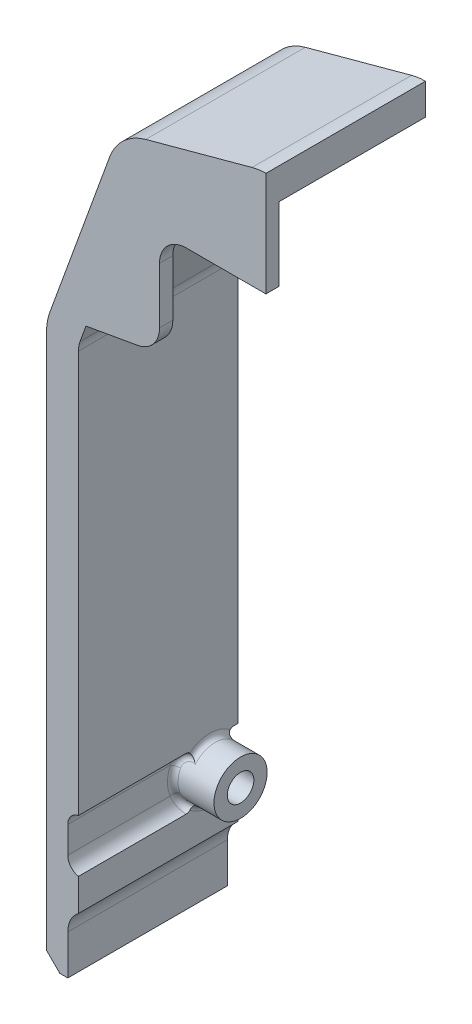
SolidWorks part; units mm, degrees
ref_plane "Face" through (0, 0, 0) normal (0, 0, 1) x (1, 0, 0)
ref_plane "Dessus" through (0, 0, 0) normal (0, 1, 0) x (1, 0, 0)
ref_plane "Droite" through (0, 0, 0) normal (1, 0, 0) x (0, 0, -1)
sketch "Esquisse1" plane through (0, 0, 0) normal (0, 0, 1) x (1, 0, 0)
  line L0 (-74.5, 0) -> (-82.5, 0)
  line L1 (-82.5, 0) -> (-82.5, 206.4735)
  line L2 (-81.2939, 213.3139) -> (-58.7478, 275.2586)
  line L3 (-45.1984, 287.7183) -> (0, 300)
  line L4 (0, 300) -> (0, 287.5649)
  line L5 (0, 287.5649) -> (-41.0513, 276.4101)
  line L6 (-47.8261, 270.1802) -> (-69.8969, 209.541)
  line L7 (-70.5, 206.1208) -> (-70.5, 54.899)
  line L8 (-74.5, 0) -> (-74.5, 15)
  line L9 (-74.5, 50) -> (-74.5, 40)
  line L10 (-70.5, 35.101) -> (-70.5, 23)
  arc A0 (-74.5, 15) -> (-70.5, 23) centre (-64.5, 15) cw
  arc A1 (-74.5, 40) -> (-70.5, 35.101) centre (-69.5, 40) ccw
  arc A2 (-74.5, 50) -> (-70.5, 54.899) centre (-69.5, 50) cw
  arc A3 (-41.0513, 276.4101) -> (-47.8261, 270.1802) centre (-38.4291, 266.76) ccw
  arc A4 (-69.8969, 209.541) -> (-70.5, 206.1208) centre (-60.5, 206.1208) ccw
  arc A5 (-82.5, 206.4735) -> (-81.2939, 213.3139) centre (-62.5, 206.4735) cw
  arc A6 (-58.7478, 275.2586) -> (-45.1984, 287.7183) centre (-39.954, 268.4182) cw
  point P24 (-82.5, 210)
  point P27 (-55.2022, 285)
  dimension "D9" = 10
  dimension "D10" = 20
  dimension "D13" = 10
  dimension "D14" = 5
  dimension "D15" = 5
  dimension "D1" = 12
  dimension "D2" = 12
  dimension "D3" = 160
  dimension "D4" = 75
  dimension "D5" = 12
  dimension "D6" = 82.5
  dimension "D7" = 300
  dimension "D8" = 210
  dimension "D11" = 8
  dimension "D12" = 15
  dimension "D16" = 40
  dimension "D17" = 10
extrude "Base-Extrusion" add sketch "Esquisse1" along normal blind 60
sketch "Esquisse2" plane through (0, 0, 60) normal (0, 0, 1) x (1, 0, 0)
  line L0 (0, 300) -> (0, 260)
  line L1 (0, 260) -> (-30, 260)
  line L2 (-40, 250) -> (-40, 228.9861)
  line L3 (-48.2635, 219.138) -> (-81.2939, 213.3139)
  line L4 (0, 300) -> (-45.1984, 287.7183)
  line L5 (-81.2939, 213.3139) -> (-58.7478, 275.2586)
  line L10 (0, 300) -> (-45.1984, 287.7183) construction
  line L11 (-58.7478, 275.2586) -> (-81.2939, 213.3139) construction
  arc A0 (-81.2939, 213.3139) -> (-82.5, 206.4735) centre (-62.5, 206.4735) ccw construction
  arc A1 (-45.1984, 287.7183) -> (-58.7478, 275.2586) centre (-39.954, 268.4182) ccw
  arc A2 (-30, 260) -> (-40, 250) centre (-30, 250) ccw
  arc A3 (-48.2635, 219.138) -> (-40, 228.9861) centre (-50, 228.9861) ccw
  point P18 (-40, 260)
  point P23 (0, 260)
  dimension "D3" = 20
  dimension "D5" = 10
  dimension "D6" = 10
  dimension "D1" = 40
  dimension "D2" = 40
  dimension "D4" = 100
extrude "Boss.-Extru.1" add sketch "Esquisse2" against normal blind 5
sketch "Esquisse3" plane through (-74.5, 0, 0) normal (1, 0, 0) x (0, 0, -1)
  circle A0 centre (-10.54, 45) radius 10
  dimension "D1" = 45
  dimension "D3" = 20
  dimension "D2" = 49.46
extrude "Boss.-Extru.2" add sketch "Esquisse3" along normal blind 15.5
fillet "Congé2" radius 2
sketch "Esquisse4" plane through (-59, 0, 0) normal (1, 0, 0) x (0, 0, -1)
  circle A0 centre (-10.54, 45) radius 5
  dimension "D1" = 10
extrude "Enlèv. mat.-Extru.1" cut sketch "Esquisse4" against normal through all
mirror "Symétrie1"
fillet "Congé3" radius 20
chamfer "Chanfrein1" distance 5 angle 45
sketch "Esquisse5" plane through (0, 0, 60) normal (0, 0, 1) x (1, 0, 0)
  line L1 (0, 0) -> (90, 0)
  line L2 (0, 0) -> (0, 310)
  line L3 (0, 310) -> (90, 310)
  line L4 (90, 0) -> (90, 310)
extrude "Enlèv. mat.-Extru.2" cut sketch "Esquisse5" against normal blind 100
